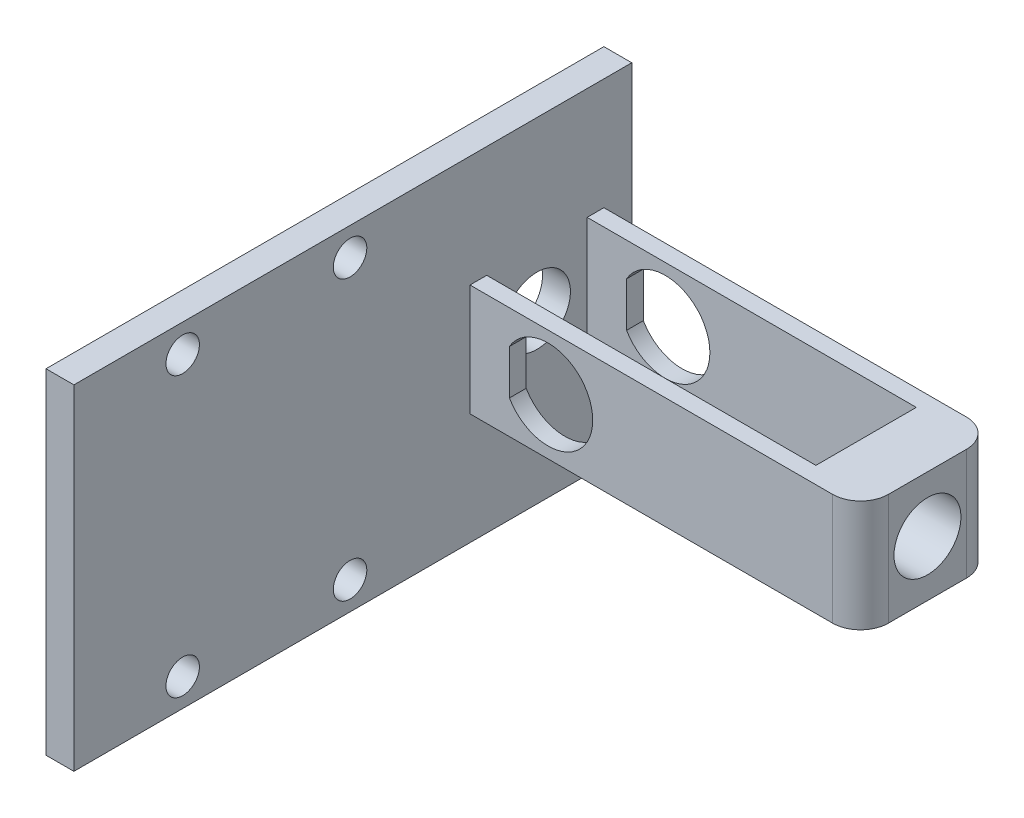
SolidWorks part; units mm, degrees
ref_plane "Front" through (0, 0, 0) normal (0, 0, 1) x (1, 0, 0)
ref_plane "Top" through (0, 0, 0) normal (0, 1, 0) x (1, 0, 0)
ref_plane "Right" through (0, 0, 0) normal (1, 0, 0) x (0, 0, -1)
sketch "Sketch1" plane through (0, 0, 0) normal (0, 0, 1) x (1, 0, 0)
  line L1 (-35, -10) -> (35, -10)
  line L2 (-35, -10) -> (-35, 10)
  line L3 (-35, 10) -> (35, 10)
  line L4 (35, -10) -> (35, 10)
  line L5 (-35, -10) -> (35, 10) construction
  line L6 (-35, 10) -> (35, -10) construction
  point P0 (0, 0)
  dimension "D1" = 20
  dimension "D2" = 70
extrude "Boss-Extrude1" add sketch "Sketch1" along normal blind 24
sketch "Sketch2" plane through (-35, 0, 0) normal (-1, 0, 0) x (0, 0, 1)
  line L0 (24, 10) -> (0, 10) construction
  line L1 (3, 10) -> (21, 10)
  line L2 (3, 10) -> (3, -10)
  line L3 (3, -10) -> (21, -10)
  line L4 (21, 10) -> (21, -10)
  line L5 (24, -10) -> (0, -10) construction
  line L6 (24, 10) -> (24, -10) construction
  line L7 (0, 10) -> (0, -10) construction
  dimension "D1" = 3
  dimension "D2" = 3
extrude "Cut-Extrude1" cut sketch "Sketch2" against normal blind 59
fillet "Fillet1" radius 5 2 edges at (35, 0, 0) (35, 0, 24)
sketch "Sketch3" plane through (-35, 0, 0) normal (-1, 0, 0) x (0, 0, 1)
  line L0 (0, 0) -> (61.8485, 0) construction
  line L1 (-5, 30) -> (95, 30)
  line L2 (-5, 30) -> (-5, -30)
  line L3 (-5, -30) -> (95, -30)
  line L4 (95, 30) -> (95, -30)
  dimension "D1" = 100
  dimension "D2" = 60
  dimension "D3" = 5
extrude "Boss-Extrude2" add sketch "Sketch3" along normal blind 5
sketch "Sketch4" plane through (24, 0, 0) normal (-1, 0, 0) x (0, 0, 1)
  line L2 (21, 10) -> (3, 10) construction
  line L3 (21, -10) -> (21, 10) construction
  circle A0 centre (12, 0) radius 6
  point P7 (12, 10)
  point P9 (21, 0)
  dimension "D1" = 12
extrude "Cut-Extrude2" cut sketch "Sketch4" against normal through all both and the other way through all
sketch "Sketch5" plane through (0, 0, 24) normal (0, 0, 1) x (1, 0, 0)
  line L0 (-35, 10) -> (-35, -10) construction
  line L1 (-27.9282, 4) -> (-27.9282, -4)
  line L2 (-21, 0) -> (-8.2678, 0) construction
  arc A0 (-27.9282, -4) -> (-27.9282, 4) centre (-21, 0) ccw
  dimension "D1" = 16
  dimension "D2" = 14
  dimension "D3" = 8
extrude "Cut-Extrude3" cut sketch "Sketch5" against normal through all
hole_wizard "Ø6.0mm Dowel Hole1" positions "Sketch7" profile "Sketch8" hole size "Ø6.0" standard "ANSI Metric"
sketch "Sketch7" plane through (-40, 0, 0) normal (-1, 0, 0) x (0, 0, 1)
  line L0 (95, 30) -> (-5, 30) construction
  line L1 (95, -30) -> (95, 30) construction
  line L2 (-5, -30) -> (95, -30) construction
  point P0 (45.5, -25)
  point P3 (75.5, -25)
  point P6 (75.5, 25)
  point P9 (45.5, 25)
  dimension "D1" = 5
  dimension "D2" = 19.5
  dimension "D3" = 30
  dimension "D4" = 5
sketch "Sketch8" plane through (-40, -25, 45.5) normal (0, 1, 0) x (0, 0, 1)
  line L0 (0, 0) -> (0, 5)
  line L1 (0, 5) -> (3, 5)
  line L2 (3, 5) -> (3, 0)
  line L5 (3, 0) -> (0, 0)
  line L11 (0, -6.35) -> (0, 107.95) construction
  dimension "Thru Hole Dia." = 6
  dimension "Thru Hole Depth" = 5
